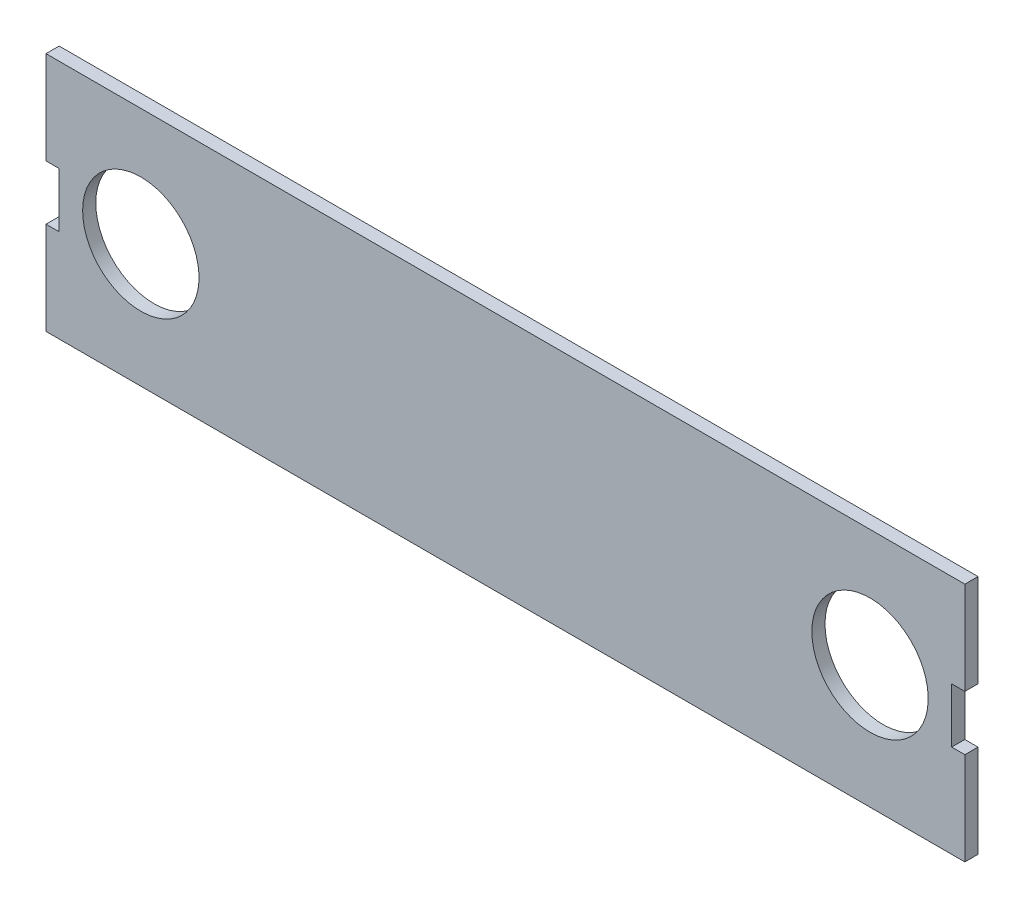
SolidWorks part; units mm, degrees
ref_plane "Front Plane" through (0, 0, 0) normal (0, 0, 1) x (1, 0, 0)
ref_plane "Top Plane" through (0, 0, 0) normal (0, 1, 0) x (1, 0, 0)
ref_plane "Right Plane" through (0, 0, 0) normal (1, 0, 0) x (0, 0, -1)
sketch "Sketch1" plane through (0, 0, 0) normal (0, 0, 1) x (1, 0, 0)
  line L0 (-1.524, -2.0513) -> (0, -2.0513)
  line L1 (-1.524, 8.7192) -> (104.9933, 8.7192)
  line L2 (-1.524, 8.7192) -> (-1.524, -2.0513)
  line L3 (-1.524, -19.1718) -> (104.9933, -19.1718)
  line L4 (104.9933, 8.7192) -> (104.9933, -2.0513)
  line L5 (0, -2.0513) -> (0, -8.4013)
  line L6 (0, -8.4013) -> (-1.524, -8.4013)
  line L7 (-1.524, -8.4013) -> (-1.524, -19.1718)
  line L8 (104.9933, -2.0513) -> (103.4693, -2.0513)
  line L9 (103.4693, -2.0513) -> (103.4693, -8.4013)
  line L10 (103.4693, -8.4013) -> (104.9933, -8.4013)
  line L11 (104.9933, -8.4013) -> (104.9933, -19.1718)
  line L12 (51.7347, 8.7192) -> (51.7347, -88.6365) construction
  circle A0 centre (9.4685, -4.905) radius 6.7437
  circle A1 centre (94.0008, -4.905) radius 6.7437
extrude "Boss-Extrude1" add sketch "Sketch1" along normal blind 1.524
